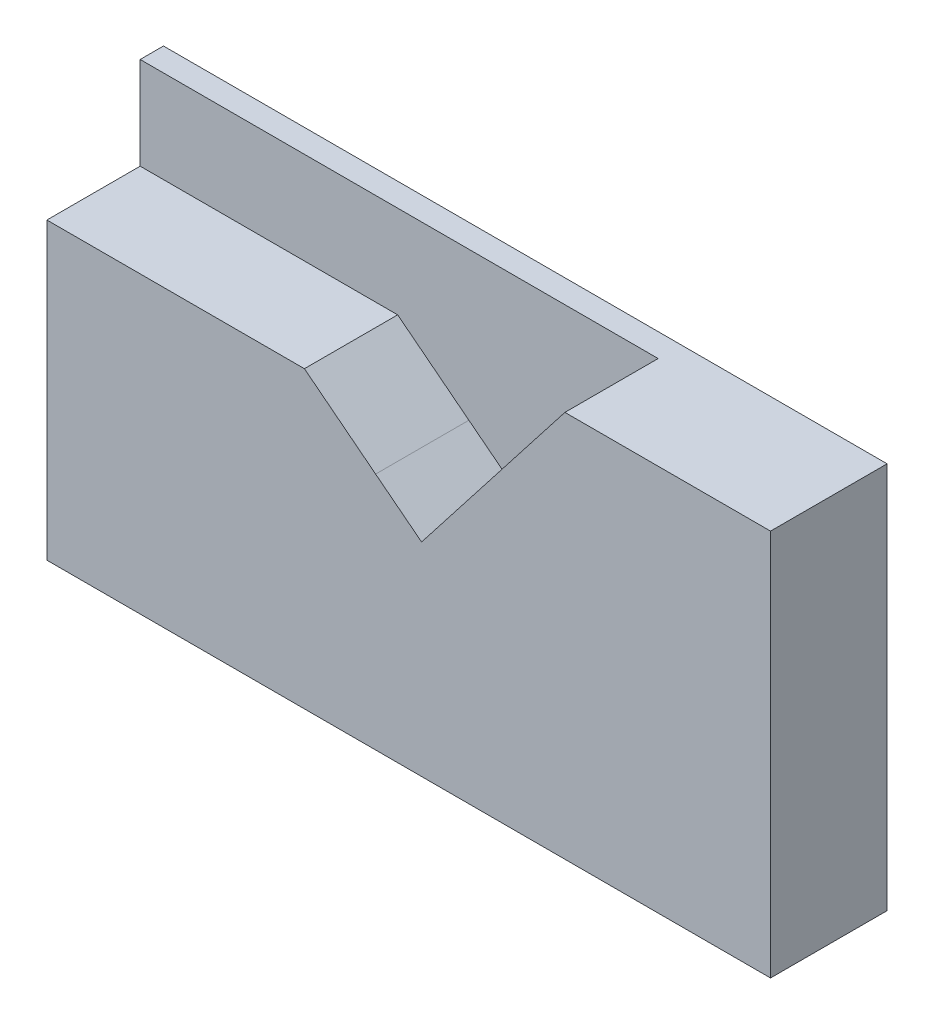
SolidWorks part; units mm, degrees
ref_plane "Front Plane" through (0, 0, 0) normal (0, 0, 1) x (1, 0, 0)
ref_plane "Top Plane" through (0, 0, 0) normal (0, 1, 0) x (1, 0, 0)
ref_plane "Right Plane" through (0, 0, 0) normal (1, 0, 0) x (0, 0, -1)
sketch "Sketch1" plane through (0, 0, 0) normal (0, 0, 1) x (1, 0, 0)
  line L0 (45.8684, 4.6797) -> (45.8684, -16.4023)
  line L1 (45.8684, -16.4023) -> (6.451, -16.4023)
  line L2 (6.451, 4.6797) -> (45.8684, 4.6797)
  line L7 (-2.4107, -6.7038) -> (45.8684, -6.7038) construction
  line L10 (6.451, 4.6797) -> (6.451, -16.4023)
  dimension "D5" = 21.082
extrude "Extrude1" add sketch "Sketch1" along normal blind 6.35
sketch "Sketch5" plane through (0, 0, 6.35) normal (0, 0, 1) x (1, 0, 0)
  line L1 (34.6676, 4.6797) -> (26.8614, -5.3379)
  line L2 (26.8614, -5.3379) -> (24.357, -3.3864)
  line L3 (24.357, -3.3864) -> (20.4787, -0.3538)
  line L4 (6.451, -0.3538) -> (20.4787, -0.3538)
  line L5 (34.6676, 4.6797) -> (32.5242, 6.3499) construction
  line L6 (34.6676, 4.6797) -> (6.451, 4.6797)
  line L7 (6.451, -0.3538) -> (6.451, 4.6797)
  dimension "D1" = 28.2167
  dimension "D2" = 3.175
  dimension "D3" = 12.7
  dimension "D4" = 14.0278
  dimension "D5" = 5.0334
  dimension "D6" = 4.9232
extrude "Cut-Extrude1" cut sketch "Sketch5" against normal blind 5.08
